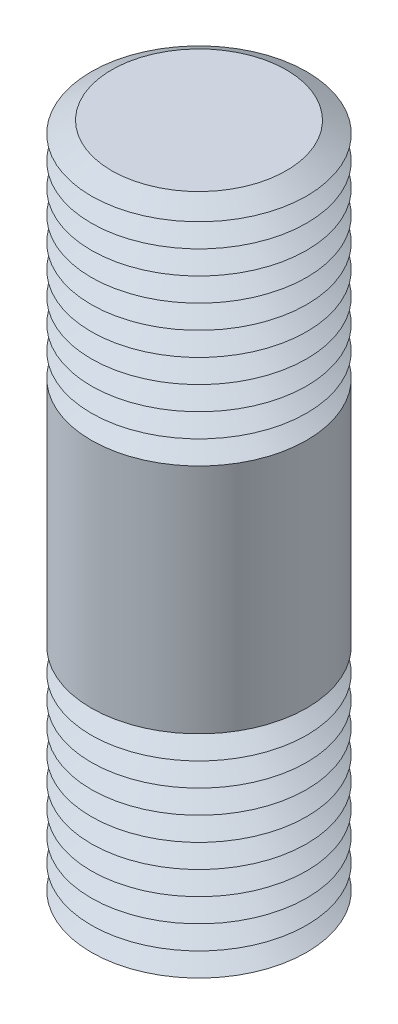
SolidWorks part; units mm, degrees
ref_plane "前基準面" through (0, 0, 0) normal (0, 0, 1) x (1, 0, 0)
ref_plane "上基準面" through (0, 0, 0) normal (0, 1, 0) x (1, 0, 0)
ref_plane "右基準面" through (0, 0, 0) normal (1, 0, 0) x (0, 0, -1)
sketch "草圖4" plane through (0, 0, 0) normal (0, 0, 1) x (1, 0, 0)
  line L2 (0, -2.9685) -> (0, 26.4101) construction
  line L3 (0, 0) -> (0, 20)
  line L4 (0, 20) -> (5.15, 20)
  line L5 (0, 0) -> (6.35, 0)
  line L6 (5.15, 20) -> (6.35, 19.3072)
  line L7 (6.35, 19.3072) -> (5.15, 18.6144)
  line L8 (5.15, 18.6144) -> (6.35, 17.9215)
  line L9 (6.35, 17.9215) -> (5.15, 17.2287)
  line L10 (5.15, 17.2287) -> (6.35, 16.5359)
  line L11 (6.35, 16.5359) -> (5.15, 15.8431)
  line L12 (5.15, 15.8431) -> (6.35, 15.1503)
  line L13 (6.35, 15.1503) -> (5.15, 14.4574)
  line L14 (5.15, 14.4574) -> (6.35, 13.7646)
  line L15 (6.35, 13.7646) -> (5.15, 13.0718)
  line L16 (5.15, 13.0718) -> (6.35, 12.379)
  line L17 (6.35, 12.379) -> (5.15, 11.6862)
  line L18 (5.15, 11.6862) -> (6.35, 10.9933)
  line L19 (6.35, 10.9933) -> (5.15, 10.3005)
  line L20 (5.15, 10.3005) -> (6.35, 9.6077)
  line L21 (6.35, 9.6077) -> (5.15, 8.9149)
  line L22 (5.15, 8.9149) -> (6.35, 8.2221)
  line L23 (5.15, 7.5292) -> (6.35, 6.8364)
  line L25 (6.35, 8.2221) -> (5.15, 7.5292)
  line L30 (6.35, 8.2221) -> (5.15, 7.5292)
  line L32 (6.35, 4.0651) -> (5.15, 3.3723)
  line L38 (6.35, 6.8364) -> (6.35, 0)
  line L39 (6.35, -0.0918) -> (5.15, -0.7846)
  line L40 (6.35, 6.8364) -> (5.15, 6.1436)
  line L41 (5.15, 6.1436) -> (6.35, 5.4508)
  line L42 (6.35, 5.4508) -> (5.15, 4.758)
  line L43 (5.15, 4.758) -> (6.35, 4.0651)
  line L44 (5.15, 3.3723) -> (6.35, 2.6795)
  line L45 (6.35, 2.6795) -> (5.15, 1.9867)
  line L46 (5.15, 1.9867) -> (6.35, 1.2939)
  line L47 (6.35, 1.2939) -> (5.15, 0.601)
  line L48 (5.15, 0.601) -> (6.35, -0.0918)
  dimension "D1" = 30
  dimension "D2" = 60
  dimension "D3" = 10.3
  dimension "D4" = 12.7
  dimension "D5" = 20
revolve "旋轉1" add sketch "草圖4" angle 360 about L2
mirror "鏡射1" about plane through (0, 0, 0) normal (0, 1, 0) of "旋轉1"
